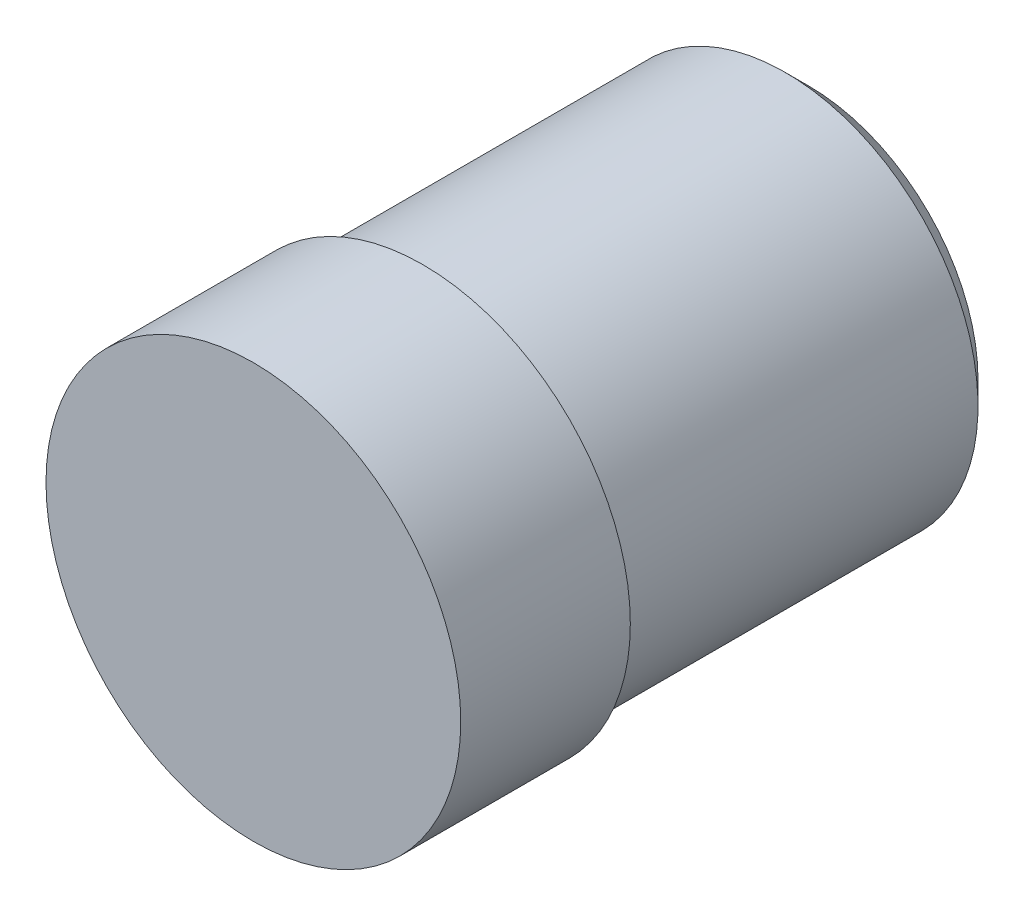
SolidWorks part; units mm, degrees
ref_plane "XY" through (0, 0, 0) normal (0, 0, 1) x (1, 0, 0)
ref_plane "XZ" through (0, 0, 0) normal (0, 1, 0) x (1, 0, 0)
ref_plane "YZ" through (0, 0, 0) normal (1, 0, 0) x (0, 0, -1)
sketch "Esquisse1" plane through (0, 0, 0) normal (0, 1, 0) x (1, 0, 0)
  line L0 (0, 0) -> (-26.9, 0)
  line L1 (-26.9, 0) -> (-26.9, 22)
  line L3 (-26.9, 22) -> (-25, 22)
  line L4 (-25, 22) -> (-25, 69)
  line L5 (-25, 69) -> (-22, 72)
  line L6 (-22, 72) -> (0, 72)
  line L7 (0, 72) -> (0, 0)
  line L8 (0, 61.8321) -> (0, -11.2733) construction
  dimension "D1" = 53.8
  dimension "D2" = 25
  dimension "D3" = 22
  dimension "D4" = 3
  dimension "D5" = 3
  dimension "D6" = 50
revolve "Base-Révolution" add sketch "Esquisse1" angle 360 about L8
